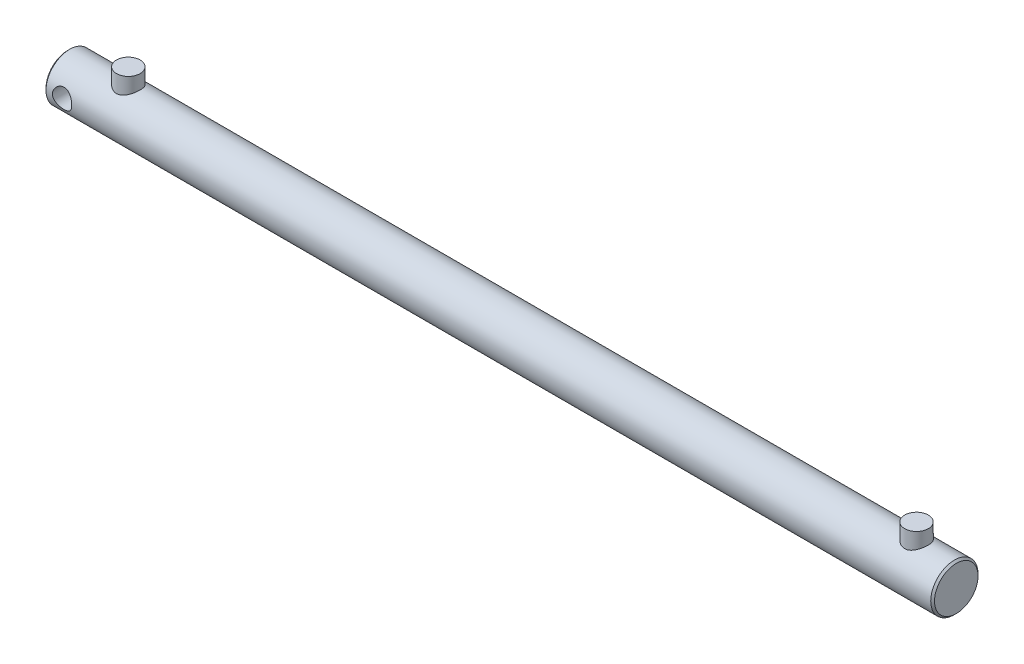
SolidWorks part; units mm, degrees
ref_plane "Plan de face" through (0, 0, 0) normal (0, 0, 1) x (1, 0, 0)
ref_plane "Plan de dessus" through (0, 0, 0) normal (0, 1, 0) x (1, 0, 0)
ref_plane "Plan de droite" through (0, 0, 0) normal (1, 0, 0) x (0, 0, -1)
sketch "Esquisse1" plane through (0, 0, 0) normal (0, 0, 1) x (1, 0, 0)
  line L0 (-469.5, 0) -> (469.5, 0) construction
  line L1 (-469.5, 0) -> (-469.5, 25)
  line L2 (-469.5, 25) -> (469.5, 25)
  line L3 (469.5, 25) -> (469.5, 0)
  line L6 (-469.5, 0) -> (469.5, 0)
  dimension "D1" = 50
  dimension "D3" = 939
revolve "Révolution1" add sketch "Esquisse1" angle 360 about L0
chamfer "Chanfrein1" distance 2 angle 45 2 edges at (469.5, 0, 25) (-469.5, 0, 25)
sketch "Esquisse3" plane through (0, 0, 0) normal (0, 0, 1) x (1, 0, 0)
  line L0 (-469.5, 23) -> (-469.5, -23) construction
  circle A0 centre (-450.5, 0) radius 10.2
  dimension "D1" = 20.4
  dimension "D2" = 19
extrude "Enlèv. mat.-Extru.1" cut sketch "Esquisse3" against normal through all and the other way through all
sketch "Esquisse5" plane through (0, 0, 0) normal (0, 1, 0) x (1, 0, 0)
  line L0 (-469.5, 23) -> (-469.5, -23) construction
  line L1 (469.5, -23) -> (469.5, 23) construction
  circle A0 centre (-405.5, 0) radius 12.5
  circle A1 centre (427.5, 0) radius 12.5
  dimension "D1" = 25
  dimension "D2" = 64
  dimension "D3" = 42
extrude "Extrusion2" add sketch "Esquisse5" along normal blind 40
